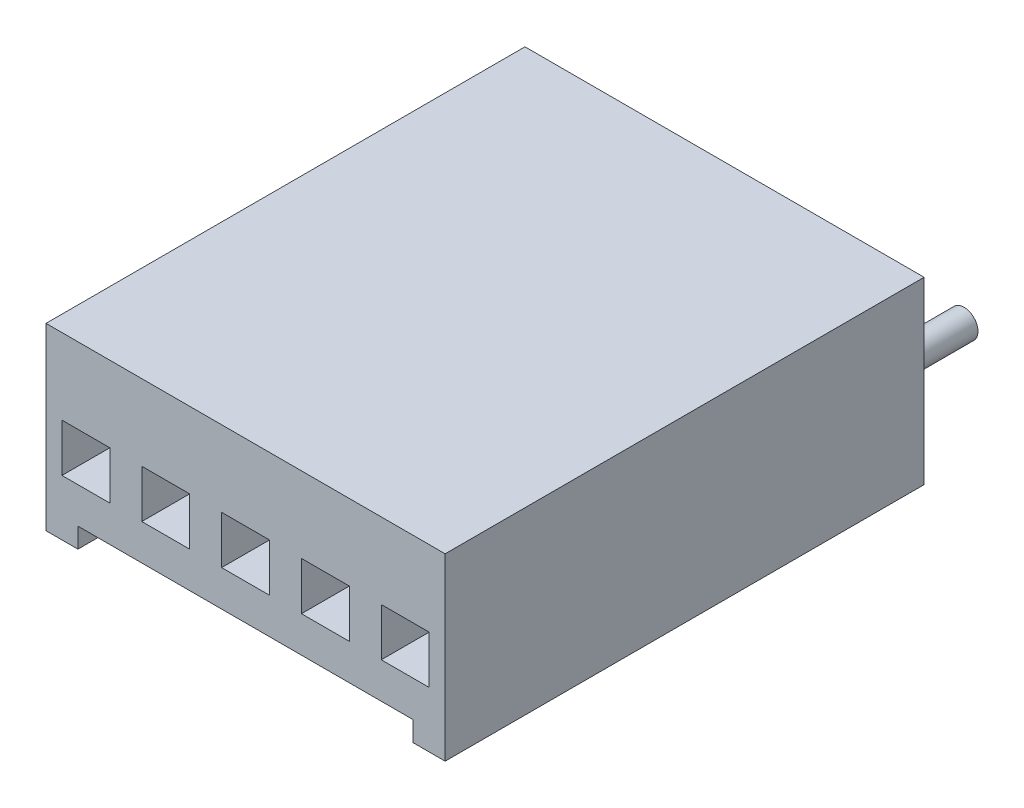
SolidWorks part; units mm, degrees
ref_plane "Front Plane" through (0, 0, 0) normal (0, 0, 1) x (1, 0, 0)
ref_plane "Top Plane" through (0, 0, 0) normal (0, 1, 0) x (1, 0, 0)
ref_plane "Right Plane" through (0, 0, 0) normal (1, 0, 0) x (0, 0, -1)
sketch "Sketch2" plane through (0, 0, 0) normal (0, 0, 1) x (1, 0, 0)
  line L1 (-1.27, 3.175) -> (11.43, 3.175)
  line L2 (-1.27, 3.175) -> (-1.27, -2.54)
  line L3 (-1.27, -2.54) -> (11.43, -2.54)
  line L4 (11.43, 3.175) -> (11.43, -2.54)
extrude "Boss-Extrude2" add sketch "Sketch2" along normal blind 2.54
sketch "Sketch3" plane through (0, 0, 2.54) normal (0, 0, 1) x (1, 0, 0)
  line L0 (-1.27, -2.54) -> (11.43, -2.54) construction
  line L1 (0, -2.54) -> (10.16, -2.54)
  line L2 (0, -2.54) -> (0, -1.905)
  line L3 (0, -1.905) -> (10.16, -1.905)
  line L4 (10.16, -2.54) -> (10.16, -1.905)
extrude "Boss-Extrude3" add sketch "Sketch3" along normal blind 7.62
sketch "Sketch4" plane through (0, 0, 2.54) normal (0, 0, 1) x (1, 0, 0)
  line L0 (11.43, -2.54) -> (11.43, 3.175) construction
  line L1 (-1.27, 3.175) -> (11.43, 3.175)
  line L2 (-1.27, 3.175) -> (-1.27, -1.905)
  line L3 (-1.27, -1.905) -> (11.43, -1.905)
  line L4 (11.43, 3.175) -> (11.43, -1.905)
extrude "Boss-Extrude4" add sketch "Sketch4" along normal blind 12.7
sketch "Sketch5" plane through (0, 0, 0) normal (0, 0, -1) x (-1, 0, 0)
  circle A0 centre (0, 0) radius 0.4445
  circle A1 centre (-2.54, 0) radius 0.4445
  circle A2 centre (-5.08, 0) radius 0.4445
  circle A3 centre (-7.62, 0) radius 0.4445
  circle A4 centre (-10.16, 0) radius 0.4445
extrude "Boss-Extrude5" add sketch "Sketch5" along normal blind 2.54
sketch "Эскиз2" plane through (0, -1.905, 0) normal (0, -1, 0) x (1, 0, 0)
  line L1 (-1.27, 15.24) -> (-0.254, 15.24)
  line L2 (-1.27, 15.24) -> (-1.27, 2.54)
  line L3 (-1.27, 2.54) -> (-0.254, 2.54)
  line L4 (-0.254, 15.24) -> (-0.254, 2.54)
  line L5 (10.414, 15.24) -> (11.43, 15.24)
  line L6 (10.414, 15.24) -> (10.414, 2.54)
  line L7 (10.414, 2.54) -> (11.43, 2.54)
  line L8 (11.43, 15.24) -> (11.43, 2.54)
extrude "Бобышка-Вытянуть1" add sketch "Эскиз2" along normal blind 0.635
sketch "Эскиз3" plane through (0, 0, 15.24) normal (0, 0, 1) x (1, 0, 0)
  line L1 (-0.762, 0.762) -> (0.762, 0.762)
  line L2 (-0.762, 0.762) -> (-0.762, -0.762)
  line L3 (-0.762, -0.762) -> (0.762, -0.762)
  line L4 (0.762, 0.762) -> (0.762, -0.762)
  line L5 (1.778, 0.762) -> (3.302, 0.762)
  line L6 (1.778, 0.762) -> (1.778, -0.762)
  line L7 (1.778, -0.762) -> (3.302, -0.762)
  line L8 (3.302, 0.762) -> (3.302, -0.762)
  line L9 (4.318, 0.762) -> (5.842, 0.762)
  line L10 (4.318, 0.762) -> (4.318, -0.762)
  line L11 (4.318, -0.762) -> (5.842, -0.762)
  line L12 (5.842, 0.762) -> (5.842, -0.762)
  line L13 (6.858, 0.762) -> (8.382, 0.762)
  line L14 (6.858, 0.762) -> (6.858, -0.762)
  line L15 (6.858, -0.762) -> (8.382, -0.762)
  line L16 (8.382, 0.762) -> (8.382, -0.762)
  line L17 (9.398, 0.762) -> (10.922, 0.762)
  line L18 (9.398, 0.762) -> (9.398, -0.762)
  line L19 (9.398, -0.762) -> (10.922, -0.762)
  line L20 (10.922, 0.762) -> (10.922, -0.762)
extrude "Вырез-Вытянуть1" cut sketch "Эскиз3" against normal blind 12.7
